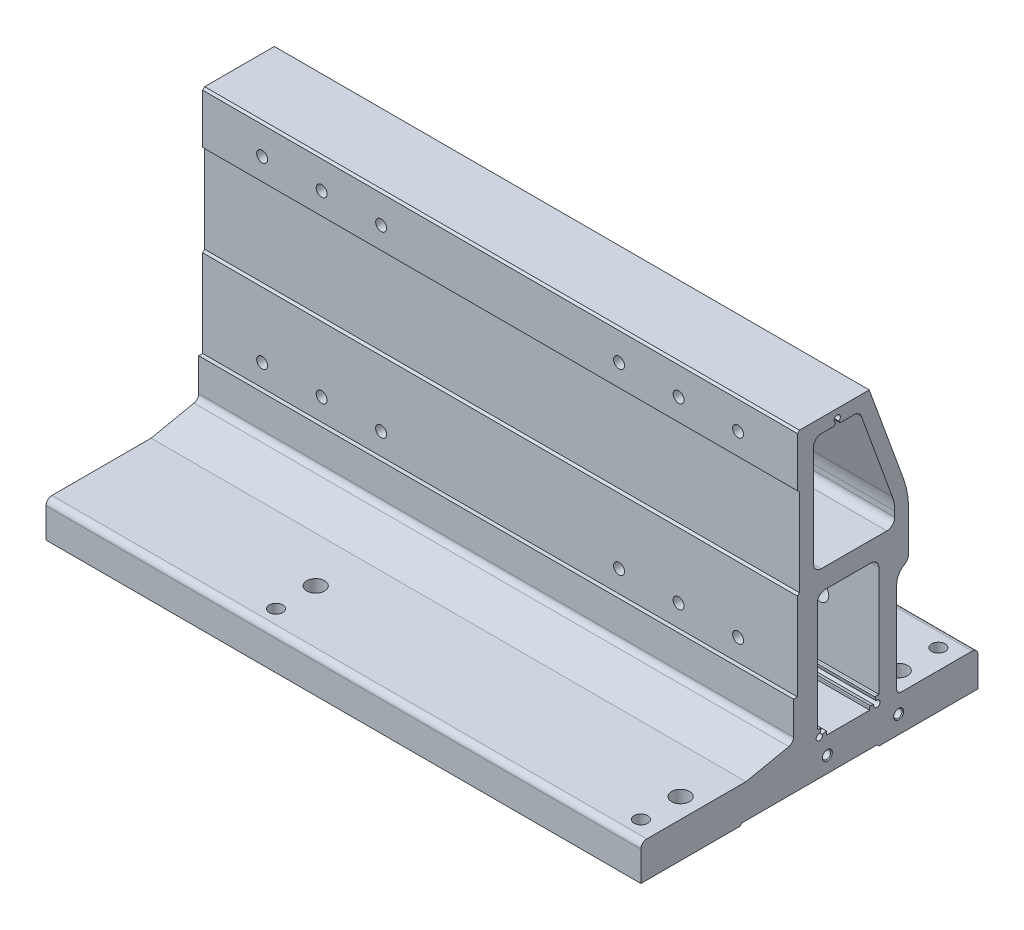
SolidWorks part; units mm, degrees
ref_plane "정면" through (0, 0, 0) normal (0, 0, 1) x (1, 0, 0)
ref_plane "윗면" through (0, 0, 0) normal (0, 1, 0) x (1, 0, 0)
ref_plane "우측면" through (0, 0, 0) normal (1, 0, 0) x (0, 0, -1)
sketch "스케치1" plane through (0, 0, 0) normal (1, 0, 0) x (0, 0, -1)
  line L0 (-5, 157) -> (-6, 156)
  line L1 (-6, 156) -> (-6, 131)
  line L2 (-6, 131) -> (-5, 130)
  line L3 (-5, 130) -> (-5, 86)
  line L4 (-5, 86) -> (-6, 85)
  line L5 (-6, 85) -> (-6, 40.9998)
  line L6 (-6, 40.9998) -> (-8, 40.9998)
  line L7 (-8, 40.9998) -> (-8, 24.4394)
  line L8 (-10.3881, 21.5025) -> (-32, 17)
  line L9 (-32, 17) -> (-82, 17)
  line L10 (-85, 14) -> (-85, -1)
  line L11 (-85, -1) -> (-35, -1)
  line L12 (-35, -1) -> (-34, 0)
  line L13 (-34, 0) -> (34, 0)
  line L14 (34, 0) -> (35, -1)
  line L15 (35, -1) -> (85, -1)
  line L16 (85, -1) -> (85, 14)
  line L17 (82, 17) -> (46, 17)
  line L18 (44, 19) -> (44, 65)
  line L19 (50, 75.3923) -> (50, 95.442)
  line L20 (47.5845, 109.1317) -> (30.149, 157)
  line L21 (30.149, 157) -> (-5, 157)
  line L22 (2, 146) -> (2, 95)
  line L23 (6, 91) -> (39, 91)
  line L24 (43, 95) -> (43, 97.7359)
  line L25 (41.7922, 104.5807) -> (26.2071, 147.369)
  line L26 (22.4487, 150) -> (15.4434, 150)
  line L27 (15.4434, 150) -> (14.8, 151.1144)
  line L28 (13.2, 151.1144) -> (12.5566, 150)
  line L29 (12.5566, 150) -> (6, 150)
  line L30 (4, 77) -> (4, 21.6)
  line L31 (4, 21.6) -> (5, 21.6)
  line L32 (5.9317, 21.4773) -> (5.4141, 19.5455)
  line L33 (6.5455, 18.4141) -> (8.4773, 18.9317)
  line L34 (8.6, 18) -> (8.6, 17)
  line L35 (8.6, 17) -> (30.4, 17)
  line L36 (30.4, 17) -> (30.4, 18)
  line L37 (30.5227, 18.9317) -> (32.4545, 18.4141)
  line L38 (33.5859, 19.5455) -> (33.0683, 21.4773)
  line L39 (34, 21.6) -> (35, 21.6)
  line L40 (35, 21.6) -> (35, 77)
  line L41 (31, 81) -> (8, 81)
  arc A0 (-10.3881, 21.5025) -> (-8, 24.4394) centre (-11, 24.4394) ccw
  arc A1 (-82, 17) -> (-85, 14) centre (-82, 14) ccw
  arc A2 (85, 14) -> (82, 17) centre (82, 14) ccw
  arc A3 (44, 19) -> (46, 17) centre (46, 19) ccw
  arc A4 (48, 71.9282) -> (44, 65) centre (52, 65) ccw
  arc A5 (48, 71.9282) -> (50, 75.3923) centre (46, 75.3923) ccw
  arc A6 (50, 95.442) -> (47.5845, 109.1317) centre (10, 95.442) ccw
  arc A7 (6, 150) -> (2, 146) centre (6, 146) ccw
  arc A8 (2, 95) -> (6, 91) centre (6, 95) ccw
  arc A9 (39, 91) -> (43, 95) centre (39, 95) ccw
  arc A10 (43, 97.7359) -> (41.7922, 104.5807) centre (23, 97.7359) ccw
  arc A11 (26.2071, 147.369) -> (22.4487, 150) centre (22.4487, 146) ccw
  arc A12 (14.8, 151.1144) -> (13.2, 151.1144) centre (14, 152.5) ccw
  arc A13 (5.9317, 21.4773) -> (5, 21.6) centre (5, 18) ccw
  arc A14 (5.4141, 19.5455) -> (6.5455, 18.4141) centre (5, 18) ccw
  arc A15 (8.6, 18) -> (8.4773, 18.9317) centre (5, 18) ccw
  arc A16 (30.5227, 18.9317) -> (30.4, 18) centre (34, 18) ccw
  arc A17 (32.4545, 18.4141) -> (33.5859, 19.5455) centre (34, 18) ccw
  arc A18 (34, 21.6) -> (33.0683, 21.4773) centre (34, 18) ccw
  arc A19 (35, 77) -> (31, 81) centre (31, 77) ccw
  arc A20 (8, 81) -> (4, 77) centre (8, 77) ccw
extrude "보스-돌출1" add sketch "스케치1" along normal mid plane 300
hole_wizard "M5 소켓 머리 캡 나사용 카운터보어1" positions "스케치2" profile "스케치3" counterbore size "M5" standard "KS"
sketch "스케치2" plane through (0, 0, -50) normal (0, 0, -1) x (-1, 0, 0)
  line L0 (-150, -1) -> (150, -1) construction
  line L1 (-150, 109.1317) -> (-150, 157) construction
  point P0 (-120, 142)
  point P2 (-60, 142)
  point P4 (-90, 142)
  point P6 (-120, 52)
  point P8 (-90, 52)
  point P10 (-60, 52)
  dimension "D1" = 53
  dimension "D2" = 90
  dimension "D3" = 30
  dimension "D4" = 30
  dimension "D5" = 30
sketch "스케치3" plane through (120, 142, -50) normal (1, 0, 0) x (0, 1, 0)
  line L0 (0, 0) -> (0, 135)
  line L1 (0, 135) -> (2.75, 135)
  line L3 (2.75, 135) -> (2.75, 49)
  line L4 (2.75, 49) -> (4.75, 49)
  line L5 (4.75, 49) -> (4.75, 0)
  line L7 (4.75, 0) -> (0, 0)
  line L11 (0, -6.35) -> (0, 107.95) construction
  dimension "관통 구멍 지름" = 5.5
  dimension "관통 구멍 깊이" = 135
  dimension "카운터보어 지름" = 9.5
  dimension "카운터보어 깊이" = 49
pattern_linear "선형 패턴1" count 2 spacing 180 along (-1, 0, 0) of "M5 소켓 머리 캡 나사용 카운터보어1"
hole_wizard "M5 나사 구멍1" positions "스케치4" profile "스케치5" tap size "M5" standard "ISO"
sketch "스케치4" plane through (150, 0, 0) normal (1, 0, 0) x (0, 0, -1)
  line L0 (85, -1) -> (85, 14) construction
  line L1 (35, -1) -> (85, -1) construction
  point P0 (9, 8)
  point P2 (45, 8)
  dimension "D1" = 40
  dimension "D2" = 36
  dimension "D3" = 9
sketch "스케치5" plane through (150, 8, -9) normal (0, 1, 0) x (0, 0, -1)
  line L0 (0, 0) -> (0, 13.2618)
  line L1 (0, 13.2618) -> (2.1, 12)
  line L2 (2.1, 12) -> (2.1, 0.425)
  line L3 (2.1, 0.425) -> (2.525, 0)
  line L5 (2.525, 0) -> (0, 0)
  line L6 (-2.1, 0.425) -> (-2.525, 0) construction
  line L10 (0, 13.2618) -> (-2.1, 12) construction
  line L11 (0, -6.35) -> (0, 107.95) construction
  dimension "탭 드릴 지름" = 4.2
  dimension "탭 드릴 깊이" = 12
  dimension "표면 카운터싱크 지름" = 5.05
  dimension "표면 카운터싱크 각도" = 90
  dimension "드릴 각도" = 118
hole_wizard "M8 나사 구멍1" positions "스케치6" profile "스케치7" tap size "M8" standard "ISO"
sketch "스케치6" plane through (0, -1, 0) normal (0, -1, 0) x (-1, 0, 0)
  line L0 (-150, 35) -> (-150, 85) construction
  line L1 (-150, 85) -> (150, 85) construction
  point P0 (44, -75)
  point P2 (-140, -75)
  point P4 (44, 75)
  point P6 (-140, 75)
  dimension "D1" = 10
  dimension "D2" = 184
  dimension "D3" = 10
  dimension "D4" = 150
sketch "스케치7" plane through (-44, -1, 75) normal (1, 0, 0) x (0, 0, -1)
  line L0 (0, 0) -> (0, 158)
  line L1 (0, 158) -> (3.4, 158)
  line L2 (3.4, 158) -> (3.4, 0.625)
  line L3 (3.4, 0.625) -> (4.025, 0)
  line L5 (4.025, 0) -> (0, 0)
  line L6 (-3.4, 0.625) -> (-4.025, 0) construction
  line L11 (0, -6.35) -> (0, 107.95) construction
  dimension "관통 탭 드릴 지름" = 6.8
  dimension "관통 탭 드릴 깊이" = 158
  dimension "표면 카운터싱크 지름" = 8.05
  dimension "표면 카운터싱크 각도" = 90
hole_wizard "Ø6.0mm 맞춤핀 구멍1" positions "스케치8" profile "스케치9" hole size "Ø6.0" standard "ISO"
sketch "스케치8" plane through (0, 0, 0) normal (0, -1, 0) x (-1, 0, 0)
  line L0 (0, 0) -> (-166.4876, 0) construction
  line L1 (-150, -34) -> (-150, 34) construction
  point P6 (-140, 0)
  point P8 (44, 0)
  dimension "D1" = 10
  dimension "D2" = 184
sketch "스케치9" plane through (-44, 0, 0) normal (1, 0, 0) x (0, 0, -1)
  line L0 (0, 0) -> (0, 11.8026)
  line L1 (0, 11.8026) -> (3, 10)
  line L2 (3, 10) -> (3, 0)
  line L5 (3, 0) -> (0, 0)
  line L10 (0, 11.8026) -> (-3, 10) construction
  line L11 (0, -6.35) -> (0, 107.95) construction
  dimension "구멍 지름" = 6
  dimension "구멍 깊이" = 10
  dimension "드릴 각도" = 118
hole_wizard "Ø9.0 (9) 지름 구멍1" positions "스케치10" profile "스케치11" hole size "Ø9.0" standard "ISO"
sketch "스케치10" plane through (0, -1, 0) normal (0, -1, 0) x (-1, 0, 0)
  line L0 (-150, 85) -> (150, 85) construction
  line L1 (-150, 35) -> (-150, 85) construction
  point P0 (44, -55)
  point P2 (-140, -55)
  point P4 (44, 55)
  point P6 (-140, 55)
  dimension "D1" = 30
  dimension "D2" = 110
  dimension "D3" = 10
  dimension "D4" = 184
sketch "스케치11" plane through (-44, -1, 55) normal (1, 0, 0) x (0, 0, -1)
  line L0 (0, 0) -> (0, 158)
  line L1 (0, 158) -> (4.5, 158)
  line L2 (4.5, 158) -> (4.5, 0)
  line L5 (4.5, 0) -> (0, 0)
  line L11 (0, -6.35) -> (0, 107.95) construction
  dimension "관통 구멍 지름" = 9
  dimension "관통 구멍 깊이" = 158
